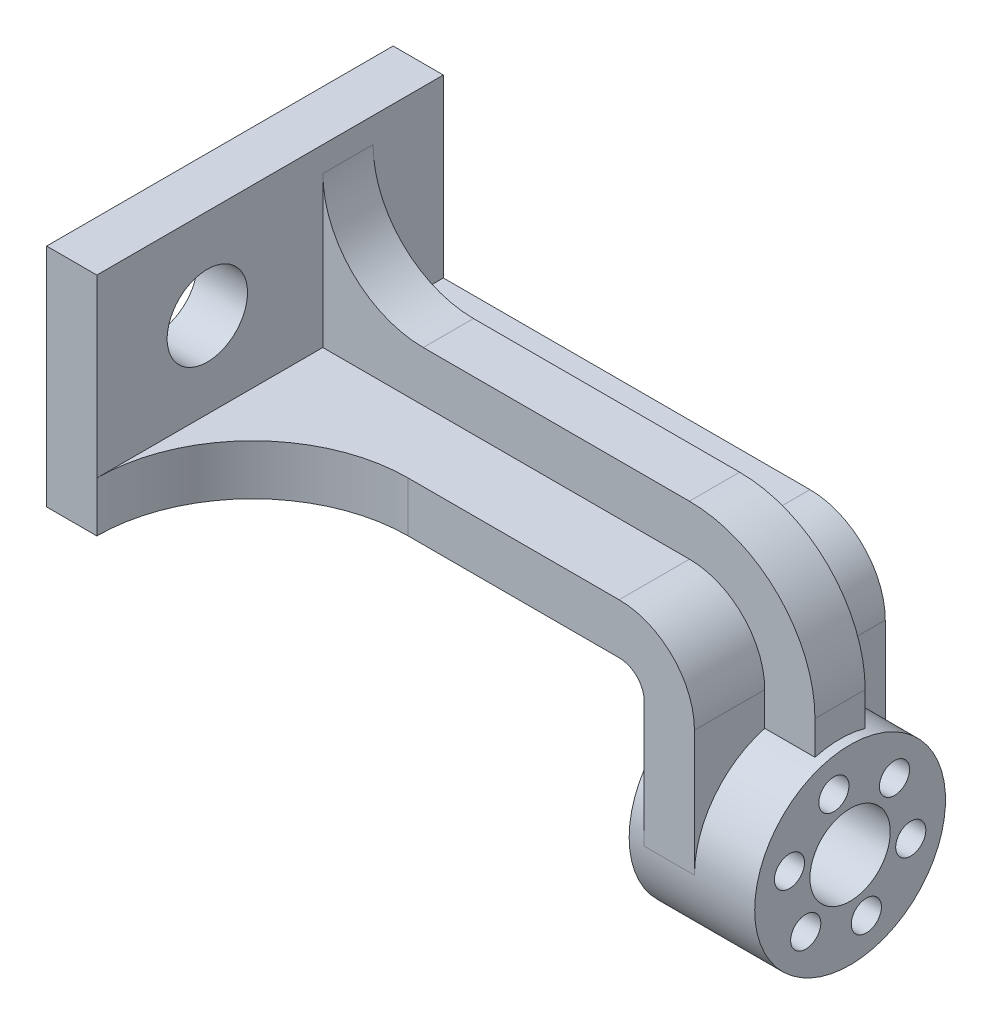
SolidWorks part; units mm, degrees
ref_plane "Front Plane" through (0, 0, 0) normal (0, 0, 1) x (1, 0, 0)
ref_plane "Top Plane" through (0, 0, 0) normal (0, 1, 0) x (1, 0, 0)
ref_plane "Right Plane" through (0, 0, 0) normal (1, 0, 0) x (0, 0, -1)
ref_plane "Plane4" through (0, 10, 0) normal (0, 1, 0) x (1, 0, 0)
sketch "Sketch1" plane through (0, 10, 0) normal (0, 1, 0) x (1, 0, 0)
  line L0 (41, -3.5) -> (10, -3.5)
  line L1 (10, -3.5) -> (10, -34.5)
  arc A0 (10, -34.5) -> (41, -3.5) centre (41, -34.5) cw
extrude "Boss-Extrude1" add sketch "Sketch1" against normal blind 10
sketch "Sketch2" plane through (0, 0, 0) normal (0, -1, 0) x (1, 0, 0)
  line L0 (10, 3.5) -> (10, 34.5)
  line L1 (41, 3.5) -> (10, 3.5)
  arc A0 (10, 34.5) -> (41, 3.5) centre (41, 34.5) ccw
extrude "Boss-Extrude2" add sketch "Sketch2" along normal blind 30
sketch "Sketch3" plane through (0, 0, 3.5) normal (0, 0, -1) x (-1, 0, 0)
  line L0 (-85, -30) -> (-85, 10)
  line L1 (-85, 10) -> (-10, 10)
  line L2 (-10, 10) -> (-10, 0)
  line L3 (-10, -30) -> (-85, -30)
  spline S0 degree 3 poles (-10, -30) (-10, -20) (-10, -10) (-10, 0) knots 0 0 0 0 1 1 1 1
extrude "Boss-Extrude3" add sketch "Sketch3" along normal blind 38
sketch "Sketch4" plane through (85, 0, 0) normal (1, 0, 0) x (0, 0, -1)
  line L0 (-3.5, -30) -> (-3.5, 10)
  line L1 (-3.5, 10) -> (34.5, 10)
  line L2 (34.5, 10) -> (34.5, -30)
  arc A0 (34.5, -30) -> (-3.5, -30) centre (15.5, -30) cw
extrude "Boss-Extrude4" add sketch "Sketch4" along normal blind 25
sketch "Sketch5" plane through (110, 0, 0) normal (1, 0, 0) x (0, 0, -1)
  line L0 (34.5, -30) -> (34.5, 10)
  line L1 (34.5, 10) -> (-3.5, 10)
  line L2 (-3.5, 10) -> (-3.5, -30)
  arc A0 (-3.5, -30) -> (34.5, -30) centre (15.5, -30) cw
extrude "Cut-Extrude1" cut sketch "Sketch5" against normal blind 12
sketch "Sketch6" plane through (0, -30, 0) normal (0, -1, 0) x (1, 0, 0)
  line L0 (10, -34.5) -> (85, -34.5)
  line L1 (85, -34.5) -> (85, 3.5)
  line L2 (85, 3.5) -> (41, 3.5)
  line L3 (10, 34.5) -> (10, -34.5)
  arc A0 (41, 3.5) -> (10, 34.5) centre (41, 34.5) cw
extrude "Cut-Extrude2" cut sketch "Sketch6" against normal blind 30
sketch "Sketch7" plane through (85, 0, 0) normal (-1, 0, 0) x (0, 0, 1)
  line L0 (3.5, -30) -> (3.5, 0)
  line L1 (3.5, 0) -> (-34.5, 0)
  line L2 (-34.5, 0) -> (-34.5, -30)
  arc A0 (-34.5, -30) -> (3.5, -30) centre (-15.5, -30) cw
extrude "Cut-Extrude3" cut sketch "Sketch7" against normal blind 3
sketch "Sketch8" plane through (10, 0, 0) normal (-1, 0, 0) x (0, 0, 1)
  line L0 (-34.5, 10) -> (34.5, 10)
  line L1 (34.5, 10) -> (34.5, 0)
  line L2 (34.5, 0) -> (-34.5, 0)
  line L3 (-34.5, 0) -> (-34.5, 10)
extrude "Boss-Extrude5" add sketch "Sketch8" along normal blind 10
sketch "Sketch9" plane through (0, 10, 0) normal (0, 1, 0) x (-1, 0, 0)
  line L0 (-10, 34.5) -> (0, 34.5)
  line L1 (0, 34.5) -> (0, -34.5)
  line L2 (0, -34.5) -> (-10, -34.5)
  line L3 (-10, -34.5) -> (-10, 34.5)
extrude "Boss-Extrude6" add sketch "Sketch9" along normal blind 35
hole_wizard "Ø16.0 (16) Diameter Hole1" positions "Sketch11" profile "Sketch10" hole size "Ø16.0" standard "ANSI Metric"
sketch "Sketch11" plane through (10, 0, 0) normal (1, 0, 0) x (0, 0, -1)
  point P0 (-12.5, 27)
sketch "Sketch10" plane through (10, 27, 12.5) normal (0, 1, 0) x (0, 0, -1)
  line L0 (0, 0) -> (0, 10)
  line L1 (0, 10) -> (8, 10)
  line L2 (8, 10) -> (8, 0)
  line L5 (8, 0) -> (0, 0)
  line L11 (0, -6.35) -> (0, 107.95) construction
  dimension "Thru Hole Dia." = 16
  dimension "Thru Hole Depth" = 10
hole_wizard "Ø16.0 (16) Diameter Hole2" positions "Sketch13" profile "Sketch12" hole size "Ø16.0" standard "ANSI Metric"
sketch "Sketch13" plane through (85, 0, 0) normal (-1, 0, 0) x (0, 0, 1)
  point P0 (-15.5, -30)
sketch "Sketch12" plane through (85, -30, -15.5) normal (0, 1, 0) x (0, 0, 1)
  line L0 (0, 0) -> (0, 25)
  line L1 (0, 25) -> (8, 25)
  line L2 (8, 25) -> (8, 0)
  line L5 (8, 0) -> (0, 0)
  line L11 (0, -6.35) -> (0, 107.95) construction
  dimension "Thru Hole Dia." = 16
  dimension "Thru Hole Depth" = 25
hole_wizard "Ø6.0 (6) Diameter Hole1" positions "Sketch15" profile "Sketch14" hole size "Ø6.0" standard "ANSI Metric"
sketch "Sketch15" plane through (85, 0, 0) normal (-1, 0, 0) x (0, 0, 1)
  point P0 (-27.5741, -33.2352)
  point P1 (-18.7352, -42.0741)
  point P2 (-6.6612, -38.8388)
  point P3 (-3.4259, -26.7648)
  point P4 (-12.2648, -17.9259)
  point P5 (-24.3388, -21.1612)
sketch "Sketch14" plane through (85, -33.2352, -27.5741) normal (0, 1, 0) x (0, 0, 1)
  line L0 (0, 0) -> (0, 25)
  line L1 (0, 25) -> (3, 25)
  line L2 (3, 25) -> (3, 0)
  line L5 (3, 0) -> (0, 0)
  line L11 (0, -6.35) -> (0, 107.95) construction
  dimension "Thru Hole Dia." = 6
  dimension "Thru Hole Depth" = 25
ref_plane "Plane5" through (0, 0, -15.5) normal (0, 0, -1) x (-1, 0, 0)
sketch "Sketch16" plane through (0, 0, -15.5) normal (0, 0, -1) x (-1, 0, 0)
  line L0 (-10, 20) -> (-108, 20)
  line L1 (-108, 20) -> (-108, -11)
rib "Rib1" sketch "Sketch16" sketch "Sketch16" thickness 10 extrusion direction parallel to sketch draft on no parameters "D1"=10
fillet "Fillet1" radius 5 1 edges at (88, 0, -15.5)
fillet "Fillet2" radius 15 2 edges at (98, 10, -3.5) (98, 10, -27.5)
fillet "Fillet3" radius 20 1 edges at (10, 20, -15.5)
fillet "Fillet4" radius 25 1 edges at (108, 20, -15.5)
